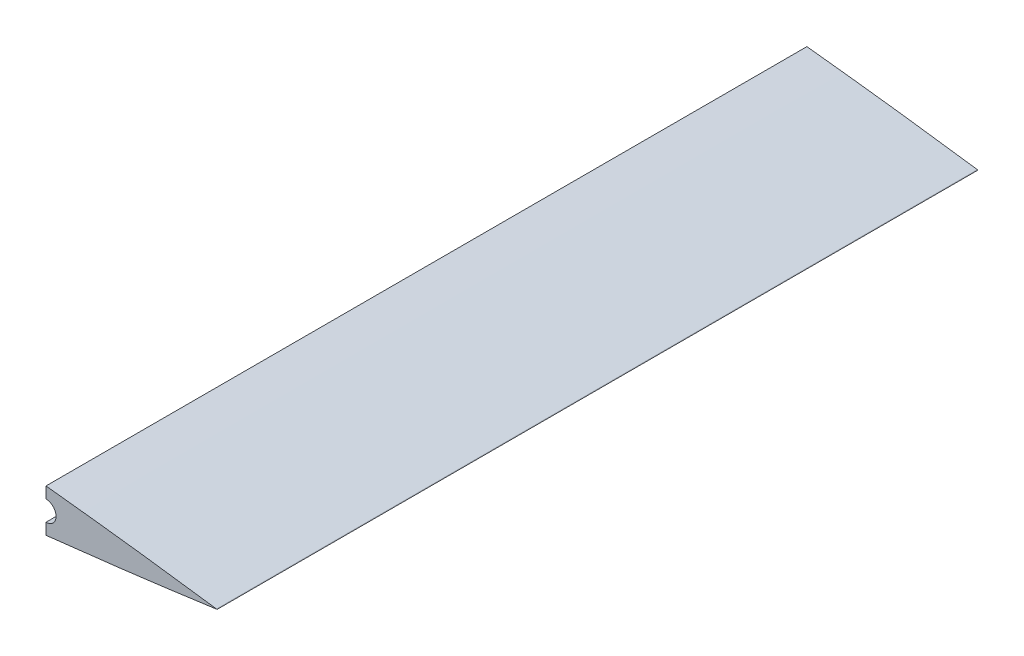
SolidWorks part; units mm, degrees
other "<HorizontalTailFlap0.125>-<Boss-Extrude4>"
ref_plane "Front Plane" through (0, 0, 0) normal (0, 0, 1) x (1, 0, 0)
ref_plane "Top Plane" through (0, 0, 0) normal (0, 1, 0) x (1, 0, 0)
ref_plane "Right Plane" through (0, 0, 0) normal (1, 0, 0) x (0, 0, -1)
mirrored part "HorizontalTailFlap0.125_Mirrored"
